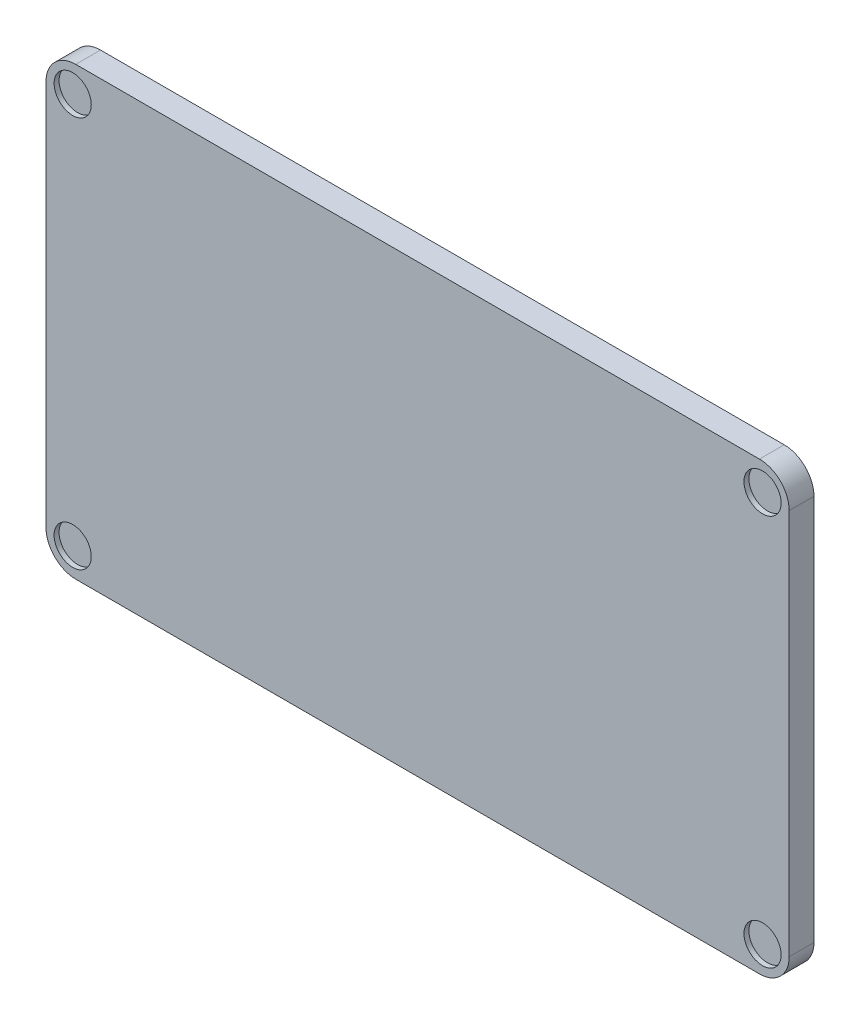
SolidWorks part; units mm, degrees
ref_plane "Plan de face" through (0, 0, 0) normal (0, 0, 1) x (1, 0, 0)
ref_plane "Plan de dessus" through (0, 0, 0) normal (0, 1, 0) x (1, 0, 0)
ref_plane "Plan de droite" through (0, 0, 0) normal (1, 0, 0) x (0, 0, -1)
sketch "Esquisse1" plane through (0, 0, 0) normal (0, 0, 1) x (1, 0, 0)
  line L1 (69, -45) -> (-69, -45)
  line L2 (75, -39) -> (75, 39)
  line L3 (69, 45) -> (-69, 45)
  line L4 (-75, -39) -> (-75, 39)
  arc A0 (-75, -39) -> (-69, -45) centre (-69, -39) ccw
  arc A1 (69, -45) -> (75, -39) centre (69, -39) ccw
  arc A2 (69, 45) -> (75, 39) centre (69, 39) cw
  arc A3 (-75, 39) -> (-69, 45) centre (-69, 39) cw
  point P0 (0, 0)
  dimension "D3" = 6
  dimension "D6" = 45
  dimension "D1" = 45
  dimension "D2" = 75
  dimension "D8" = 75
extrude "Boss.-Extru.1" add sketch "Esquisse1" along normal blind 5
sketch "Esquisse3" plane through (0, 0, 5) normal (0, 0, 1) x (1, 0, 0)
  line L7 (0, 37.5837) -> (0, -30.332) construction
  line L8 (-45.8742, 0) -> (45.2953, 0) construction
  line L9 (69, 45) -> (-69, 45) construction
  line L16 (-75, 39) -> (-75, -39) construction
  circle A16 centre (-69.6196, 39.4938) radius 3.75
  circle A18 centre (69.6196, 39.4938) radius 3.75
  circle A19 centre (69.6196, -39.4938) radius 3.75
  circle A20 centre (-69.6196, -39.4938) radius 3.75
  point P0 (0, 0)
  point P9 (0, 0)
  dimension "D3" = 5.3804
  dimension "D4" = 5.5062
  dimension "D1" = 7.5
extrude "Enlèv. mat.-Extru.1" cut sketch "Esquisse3" against normal blind 1
